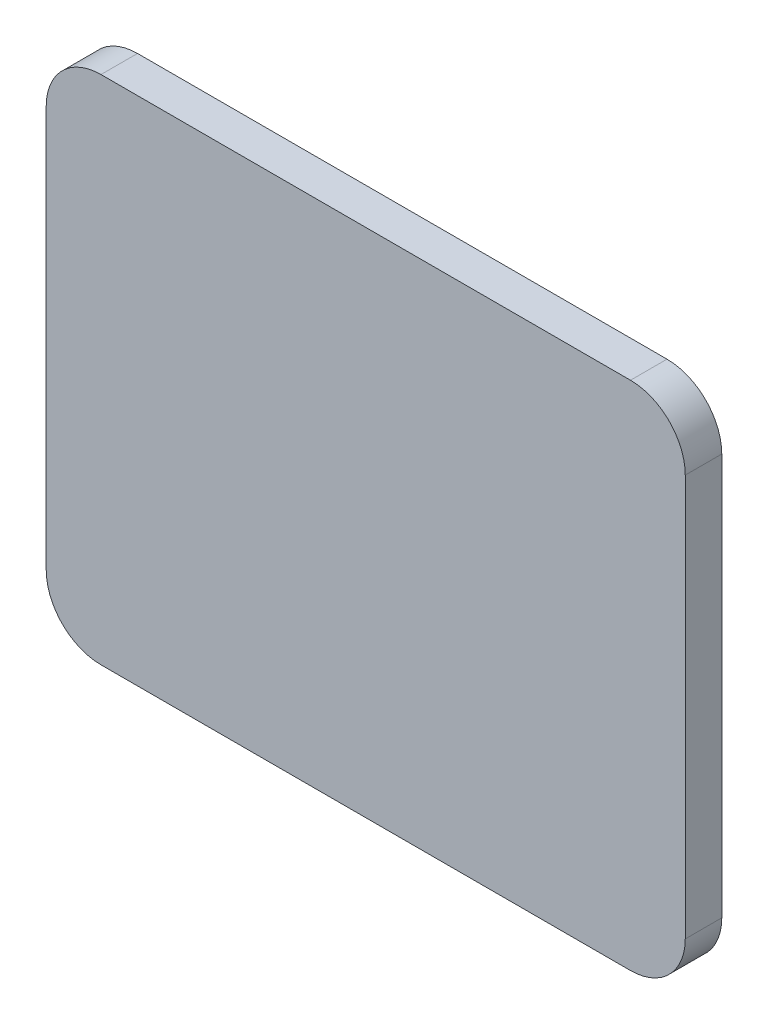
SolidWorks part; units mm, degrees
ref_plane "정면" through (0, 0, 0) normal (0, 0, 1) x (1, 0, 0)
ref_plane "윗면" through (0, 0, 0) normal (0, 1, 0) x (1, 0, 0)
ref_plane "우측면" through (0, 0, 0) normal (1, 0, 0) x (0, 0, -1)
sketch "스케치1" plane through (0, 0, 0) normal (0, 0, 1) x (1, 0, 0)
  line L1 (-80.9185, 58.3796) -> (-78.0185, 58.3796)
  line L2 (-81.2185, 58.0796) -> (-81.2185, 55.8796)
  line L3 (-80.9185, 55.5796) -> (-78.0185, 55.5796)
  line L4 (-77.7185, 58.0796) -> (-77.7185, 55.8796)
  line L5 (-81.2185, 58.3796) -> (-77.7185, 55.5796) construction
  line L6 (-81.2185, 55.5796) -> (-77.7185, 58.3796) construction
  arc A0 (-81.2185, 55.8796) -> (-80.9185, 55.5796) centre (-80.9185, 55.8796) ccw
  arc A1 (-78.0185, 55.5796) -> (-77.7185, 55.8796) centre (-78.0185, 55.8796) ccw
  arc A2 (-77.7185, 58.0796) -> (-78.0185, 58.3796) centre (-78.0185, 58.0796) ccw
  arc A3 (-81.2185, 58.0796) -> (-80.9185, 58.3796) centre (-80.9185, 58.0796) cw
  point P0 (-79.4685, 56.9796)
  dimension "D1" = 0.3
extrude "보스-돌출1" add sketch "스케치1" along normal blind 0.2
